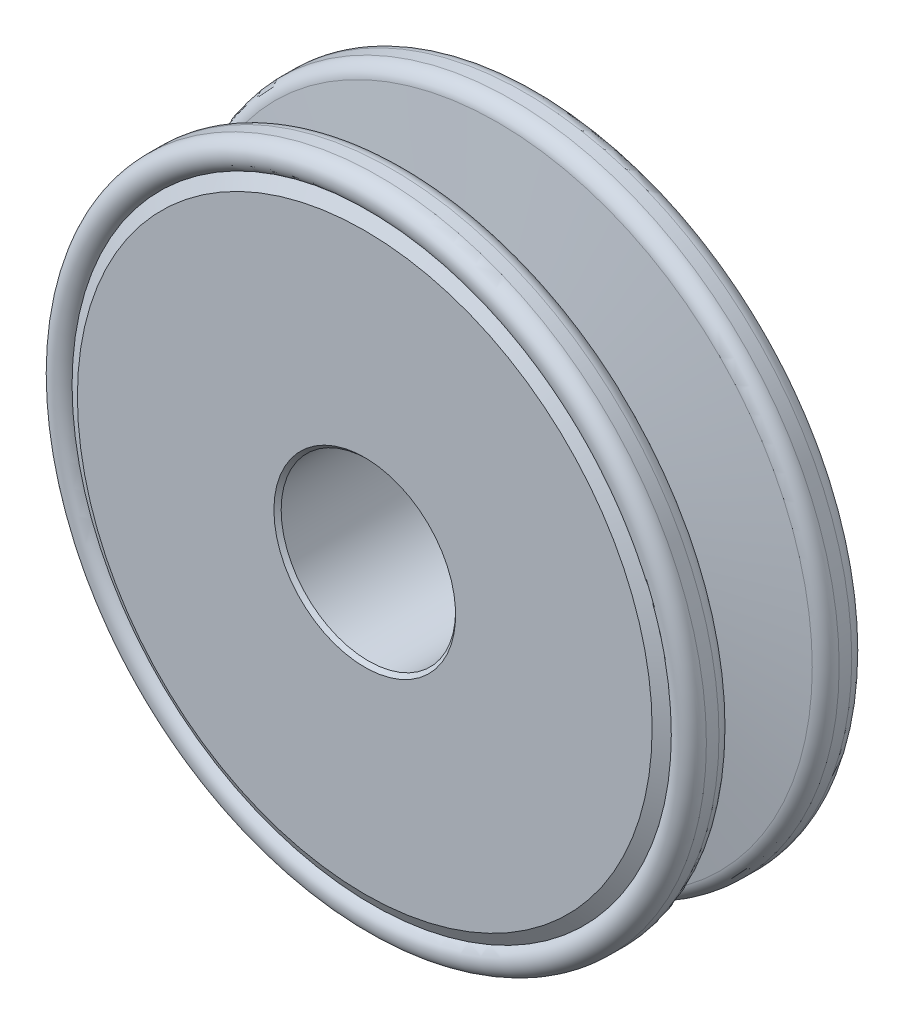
SolidWorks part; units mm, degrees
ref_plane "Спереди" through (0, 0, 0) normal (0, 0, 1) x (1, 0, 0)
ref_plane "Сверху" through (0, 0, 0) normal (0, 1, 0) x (1, 0, 0)
ref_plane "Справа" through (0, 0, 0) normal (1, 0, 0) x (0, 0, -1)
sketch "Эскиз1" plane through (0, 0, 0) normal (1, 0, 0) x (0, 0, -1)
  line L0 (-6, 0) -> (6, 0) construction
  line L1 (-6, 6) -> (6, 6)
  line L2 (6, 6) -> (6, 19.7679)
  line L3 (-6, 6) -> (-6, 19.7679)
  line L4 (-2, 13.5) -> (2, 13.5)
  line L5 (0, 13.5) -> (0, 6) construction
  line L6 (-5, 22.5) -> (-4.1342, 22.5)
  line L7 (-3.1439, 21.6392) -> (-2, 13.5)
  line L8 (2, 13.5) -> (3.1439, 21.6392)
  line L9 (4.1342, 22.5) -> (5, 22.5)
  line L10 (-5.5, 20.634) -> (-6, 19.7679)
  line L11 (5.5, 20.634) -> (6, 19.7679)
  arc A0 (6, 21.5) -> (5, 22.5) centre (5, 21.5) ccw
  arc A1 (3.1439, 21.6392) -> (4.1342, 22.5) centre (4.1342, 21.5) cw
  arc A2 (-4.1342, 22.5) -> (-3.1439, 21.6392) centre (-4.1342, 21.5) cw
  arc A3 (-6, 21.5) -> (-5, 22.5) centre (-5, 21.5) cw
  arc A4 (-6, 21.5) -> (-5.5, 20.634) centre (-5, 21.5) ccw
  arc A5 (6, 21.5) -> (5.5, 20.634) centre (5, 21.5) cw
  dimension "D7" = 1
  dimension "D8" = 1
  dimension "D9" = 1
  dimension "D1" = 12
  dimension "D2" = 12
  dimension "D3" = 27
  dimension "D4" = 45
  dimension "D5" = 16
  dimension "D6" = 4
  dimension "D11" = 30
revolve "Повернуть1" add sketch "Эскиз1" angle 360 about L0
chamfer "Фаска1" distance 0.25 angle 45 2 edges at (6, 0, 6) (6, 0, -6)
